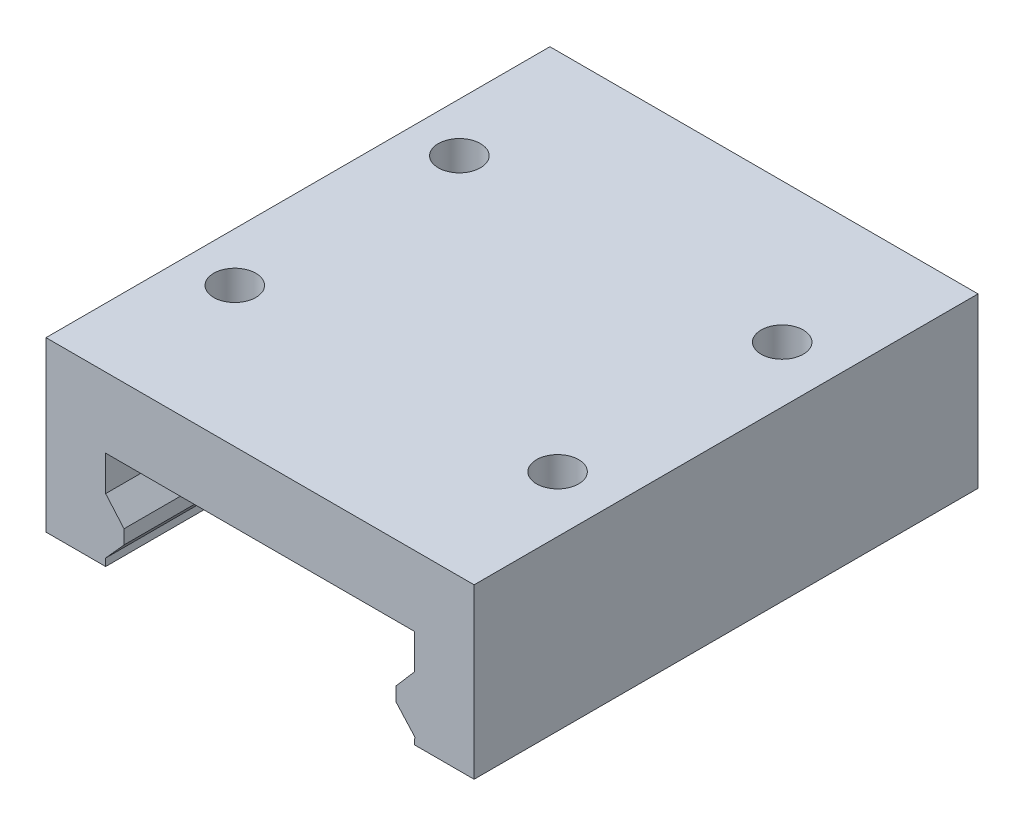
SolidWorks part; units mm, degrees
ref_plane "Plan de face" through (0, 0, 0) normal (0, 0, 1) x (1, 0, 0)
ref_plane "Plan de dessus" through (0, 0, 0) normal (0, 1, 0) x (1, 0, 0)
ref_plane "Plan de droite" through (0, 0, 0) normal (1, 0, 0) x (0, 0, -1)
sketch "Esquisse1" plane through (0, 0, 0) normal (0, 0, 1) x (1, 0, 0)
  line L0 (-22, 3) -> (-30.5, 3)
  line L1 (-30.5, 3) -> (-30.5, 27)
  line L2 (-30.5, 27) -> (30.5, 27)
  line L3 (0, 27) -> (0, 17)
  line L4 (21, 17) -> (-21, 17)
  line L5 (-22, 3) -> (-22.054, 3.9985)
  line L6 (-22.054, 3.9985) -> (-19.3823, 6.9755)
  line L7 (-19.3823, 6.9755) -> (-19.3823, 8.9755)
  line L8 (-19.3823, 8.9755) -> (-22, 12)
  line L9 (-22, 12) -> (-22, 17)
  line L10 (-22, 17) -> (-21, 17)
  line L11 (0, 36.9361) -> (0, -7.5281) construction
  line L12 (22, 17) -> (21, 17)
  line L13 (22, 12) -> (22, 17)
  line L14 (19.3823, 8.9755) -> (22, 12)
  line L15 (19.3823, 6.9755) -> (19.3823, 8.9755)
  line L16 (22.054, 3.9985) -> (19.3823, 6.9755)
  line L17 (22, 3) -> (22.054, 3.9985)
  line L18 (30.5, 3) -> (30.5, 27)
  line L19 (22, 3) -> (30.5, 3)
  dimension "D1" = 3
  dimension "D2" = 22
  dimension "D3" = 8.5
  dimension "D4" = 2
  dimension "D5" = 10
  dimension "D6" = 21
  dimension "D7" = 4
  dimension "D8" = 4
  dimension "D9" = 135
  dimension "D10" = 8.5
  dimension "D11" = 8.5
  dimension "D12" = 5
  dimension "D13" = 1
  dimension "D14" = 24
  dimension "D15" = 1
extrude "Extrusion1" add sketch "Esquisse1" along normal blind 71.8 contours L9 L10 L4 L3 L2 L1 L0 L5 L6 L7 L8
sketch "Esquisse3" plane through (0, 27, 0) normal (0, 1, 0) x (-1, 0, 0)
  line L0 (-30.5, 71.8) -> (-30.5, 0) construction
  line L1 (30.5, 71.8) -> (-30.5, 71.8) construction
  circle A0 centre (23.5, 19.9) radius 3
  circle A1 centre (-22.5, 19.9) radius 3
  circle A2 centre (-22.5, 51.9) radius 3
  circle A3 centre (23.5, 51.9) radius 3
  dimension "D7" = 6
  dimension "D8" = 6
  dimension "D9" = 6
  dimension "D10" = 6
  dimension "D1" = 46
  dimension "D2" = 8
  dimension "D3" = 8
  dimension "D4" = 46
  dimension "D5" = 32
  dimension "D6" = 19.9
extrude "Percage" cut sketch "Esquisse3" against normal blind 6
